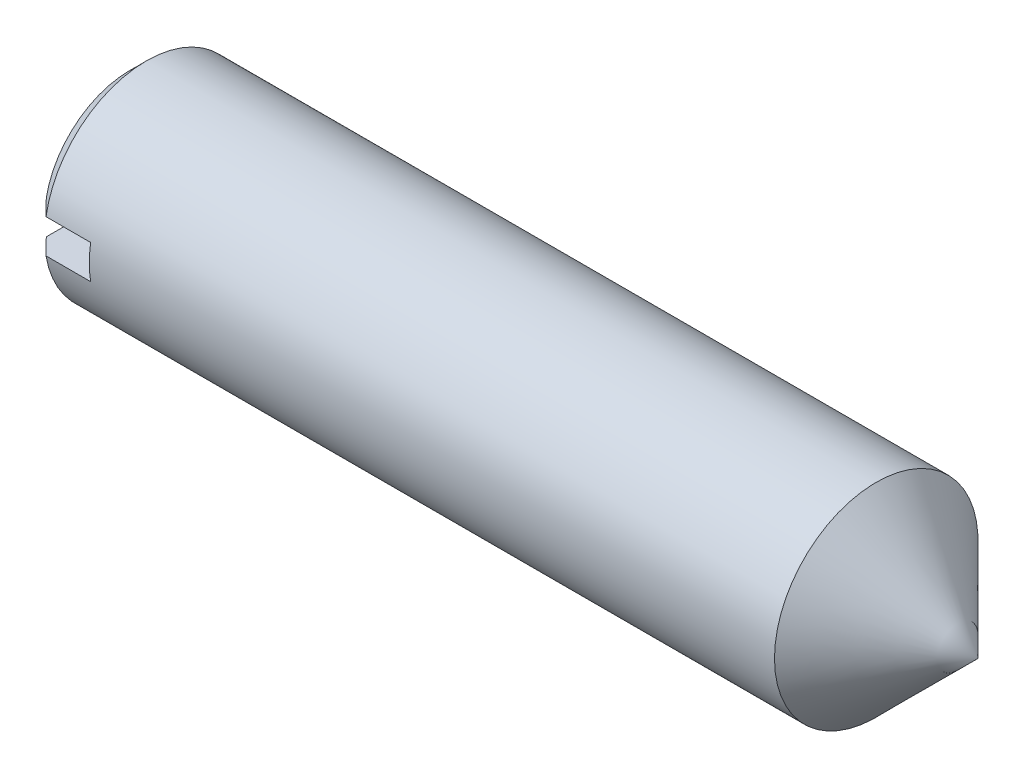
SolidWorks part; units mm, degrees
ref_plane "Front Plane" through (0, 0, 0) normal (0, 0, 1) x (1, 0, 0)
ref_plane "Top Plane" through (0, 0, 0) normal (0, 1, 0) x (1, 0, 0)
ref_plane "Right Plane" through (0, 0, 0) normal (1, 0, 0) x (0, 0, -1)
sketch "BodySke" plane through (0, 0, 0) normal (0, 0, 1) x (1, 0, 0)
  line L0 (0, 0) -> (88.3411, 0) construction
  line L1 (0, 0) -> (0, 5.036)
  line L2 (0, 5.036) -> (0.964, 6)
  line L3 (0.964, 6) -> (44, 6)
  line L4 (50, 0) -> (44, 6)
  line L5 (0.964, -6) -> (44, -6) construction
  line L6 (50, 0) -> (0, 0)
  line L7 (1.75, 0) -> (1.75, 8.5388) construction
  line L8 (0, -5.036) -> (0.964, -6) construction
  line L9 (50, 0) -> (44, -6) construction
  dimension "Diameter" = 12
  dimension "Thread_minor" = 10.072
  dimension "Length" = 50
  dimension "Drive_chamfer_angle" = 90
  dimension "Advance" = 1.75
  dimension "Cone_angle" = 90
revolve "BaseBody" add sketch "BodySke" angle 360 about L0
sketch "SlotSke" plane through (0, 0, 0) normal (1, 0, 0) x (0, 0, -1)
  line L0 (-6, 1) -> (6, -1) construction
  line L1 (-6, 1) -> (6, 1)
  line L2 (-6, 1) -> (-6, -1)
  line L3 (-6, -1) -> (6, -1)
  line L4 (6, 1) -> (6, -1)
  dimension "D1" = 12
  dimension "Slot_width" = 2
extrude "Slot" cut sketch "SlotSke" along normal blind 3.6
sketch "ThdSchSke" plane through (0, 0, 0) normal (0, 0, 1) x (1, 0, 0)
  line L0 (0, 0) -> (53.6961, 0) construction
  line L1 (1.6009, 7.1131) -> (1.6009, 6)
  line L2 (1.6009, 7.1131) -> (2.714, 7.1131)
  line L3 (2.714, 7.1131) -> (2.714, 6)
  line L4 (2.714, 6) -> (2.1574, 5.036)
  line L5 (2.1574, 5.036) -> (1.6009, 6)
  dimension "D1" = 1.75
revolve "ThreadSchematic" [suppressed] cut sketch "ThdSchSke" angle 360 about L0
pattern_linear "ThdSchPat" [suppressed]
equation "\"Thread_minor@ThreadCosmetic\" = \"Thread_minor@BodySke\""
equation "\"D1@SlotSke\" = \"Diameter@BodySke\""
equation "\"D1@ThdSchSke\" = \"Advance@BodySke\""
equation "\"Advance@ThdSchPat\" = \"Advance@BodySke\""
equation "\"Tooth_Num@ThdSchPat\" =  int( \"Length@BodySke\" / \"Advance@BodySke\" )  - 1"
